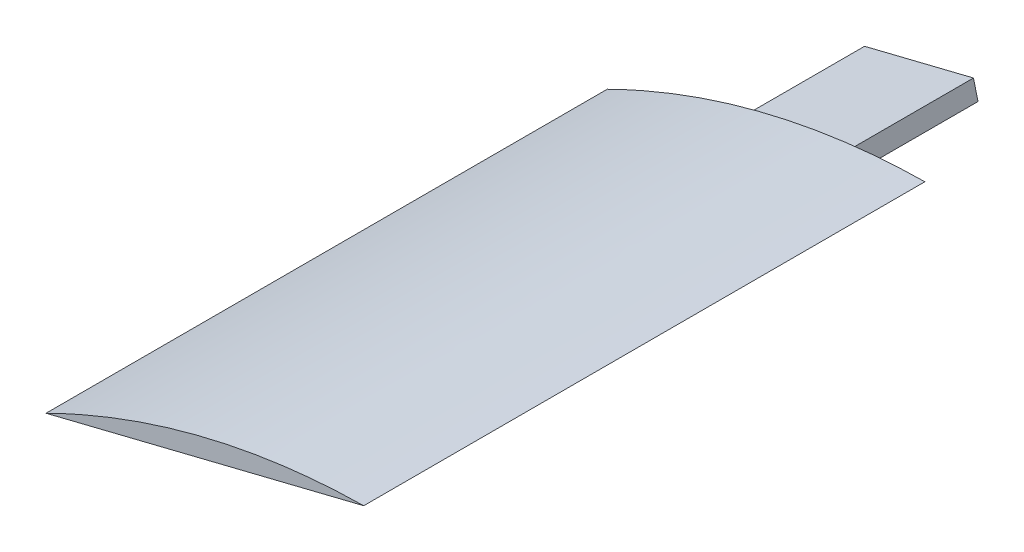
SolidWorks part; units mm, degrees
ref_plane "Alzado" through (0, 0, 0) normal (0, 0, 1) x (1, 0, 0)
ref_plane "Planta" through (0, 0, 0) normal (0, 1, 0) x (1, 0, 0)
ref_plane "Vista lateral" through (0, 0, 0) normal (1, 0, 0) x (0, 0, -1)
sketch "Croquis1" plane through (0, 0, 0) normal (0, 0, 1) x (1, 0, 0)
  line L0 (0, 0) -> (169.8591, 42.1056)
  line L1 (0, 0) -> (0, -74.58) construction
  spline S0 degree 2 poles (0, 0) (82.5128, 40.8467) (169.8591, 42.1056) knots 0 0 0 0.940201 0.940201 0.940201
  dimension "D1" = 175
extrude "Saliente-Extruir1" add sketch "Croquis1" along normal blind 300
sketch "Croquis4" plane through (0, 0, 0) normal (0.2406, -0.9706, 0) x (0.9706, 0.2406, 0)
  line L0 (66.9929, 67.4318) -> (66.9929, -72.5682)
  line L1 (66.9929, -72.5682) -> (126.9929, -72.5682)
  line L2 (96.9929, 67.4318) -> (126.9929, 67.4318)
  line L3 (96.9929, 67.4318) -> (66.9929, 67.4318)
  line L4 (126.9929, -72.5682) -> (126.9929, 67.4318)
  dimension "D1" = 30
  dimension "D2" = 30
  dimension "D3" = 140
extrude "Saliente-Extruir2" add sketch "Croquis4" along normal blind 10
